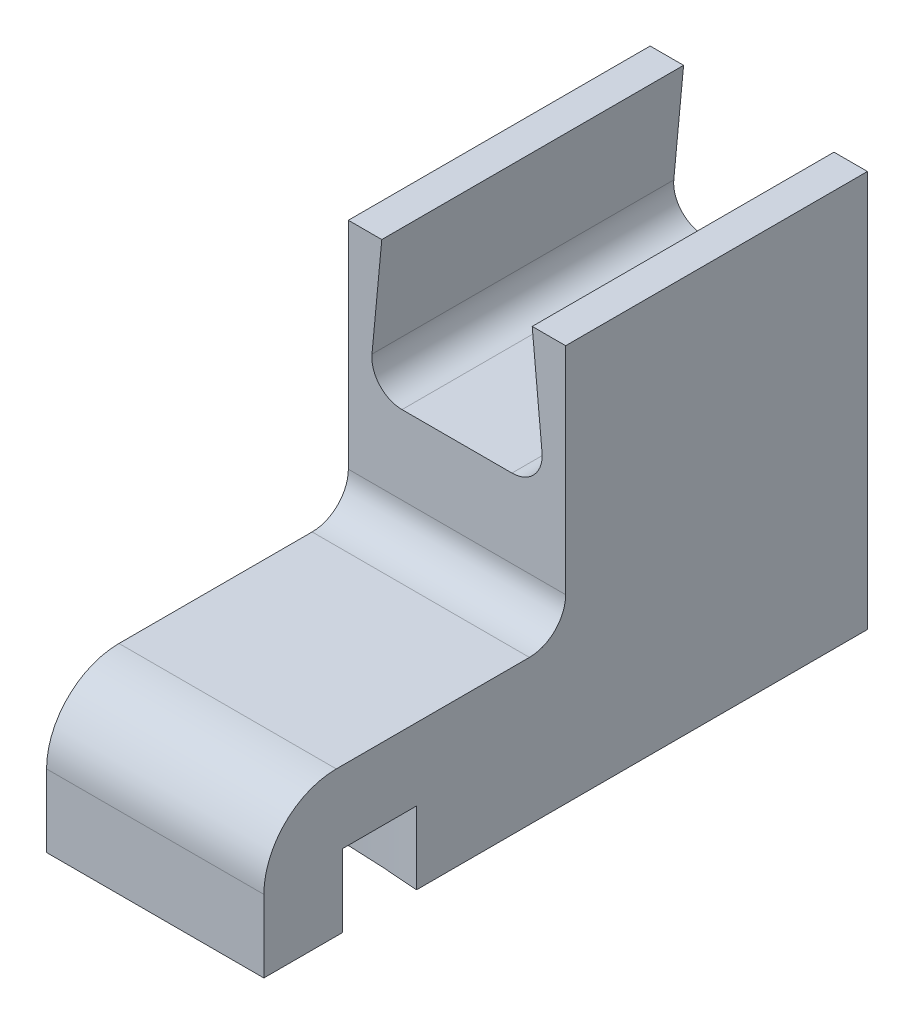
SolidWorks part; units mm, degrees
ref_plane "Alzado" through (0, 0, 0) normal (0, 0, 1) x (1, 0, 0)
ref_plane "Planta" through (0, 0, 0) normal (0, 1, 0) x (1, 0, 0)
ref_plane "Vista lateral" through (0, 0, 0) normal (1, 0, 0) x (0, 0, -1)
sketch "Croquis1" plane through (0, 0, 0) normal (0, 0, 1) x (1, 0, 0)
  line L0 (-9, 4.26) -> (-9, -28.6)
  line L1 (-9, -28.6) -> (9, -28.6)
  line L2 (0, -7.1) -> (0, -28.6) construction
  line L10 (9, -28.6) -> (9, 4.26)
  line L11 (9, 4.26) -> (6.23, 4.26)
  line L12 (6.23, 4.26) -> (7.3, -7.1)
  line L13 (7.3, -7.1) -> (-7.3, -7.1)
  line L14 (-7.3, -7.1) -> (-6.23, 4.26)
  line L15 (-6.23, 4.26) -> (-9, 4.26)
  line L18 (-6.23, 4.26) -> (6.23, 4.26) construction
  line L19 (0, 4.26) -> (0, -7.1) construction
extrude "Saliente-Extruir1" add sketch "Croquis1" along normal blind 25
sketch "Croquis2" plane through (0, -28.6, 0) normal (0, -1, 0) x (1, 0, 0)
  line L0 (-9, 25) -> (-9, 37)
  line L1 (-9, 37) -> (9, 37)
  line L2 (9, 37) -> (9, 25)
  line L3 (-9, 25) -> (9, 25) construction
  line L4 (-9, 43.4318) -> (-9, 50)
  line L5 (-9, 50) -> (9, 50)
  line L6 (9, 50) -> (9, 43.4318)
  line L7 (-9, 25) -> (9, 25)
  line L8 (0, 25) -> (0, 0) construction
  circle A0 centre (0, 137) radius 100
  circle A1 centre (0, 137) radius 94
  dimension "D2" = 200
  dimension "D1" = 12
  dimension "D4" = 25
  dimension "D5" = 18
  dimension "D3" = 6
sketch "Croquis3" plane through (0, -28.6, 0) normal (0, -1, 0) x (1, 0, 0)
  line L1 (-9, 50) -> (9, 50)
  line L2 (-9, 50) -> (-9, 25)
  line L3 (-9, 25) -> (9, 25)
  line L4 (9, 50) -> (9, 25)
extrude "Saliente-Extruir2" add sketch "Croquis3" against normal blind 12
sketch "Croquis4" plane through (0, -28.6, 0) normal (0, -1, 0) x (1, 0, 0)
  line L0 (-9, 43.4821) -> (-9, 37.3556)
  line L1 (-9, 50) -> (-9, 0) construction
  line L2 (9, 43.4821) -> (9, 37.3556)
  line L3 (9, 50) -> (9, 43.4318) construction
  line L4 (9, 0) -> (9, 50) construction
  line L5 (-9, 43.4318) -> (-9, 50) construction
  circle A3 centre (0, 137) radius 100.05
  arc A4 (-9, 37.3556) -> (9, 37.3556) centre (0, 137) ccw
  circle A5 centre (0, 137) radius 93.95
  arc A6 (-9, 43.4821) -> (9, 43.4821) centre (0, 137) ccw
  dimension "D1" = 0.05
  dimension "D2" = 0.05
extrude "Cortar-Extruir1" cut sketch "Croquis4" against normal blind 6.02
fillet "Redondeo1" radius 2.5 2 edges at (-7.3, -7.1, 12.5) (7.3, -7.1, 12.5)
fillet "Redondeo2" radius 6 1 edges at (0, -16.6, 50)
fillet "Redondeo3" radius 3 1 edges at (0, -16.6, 25)
equation "\"D9@Croquis1\"= \"D8@Croquis1\""
